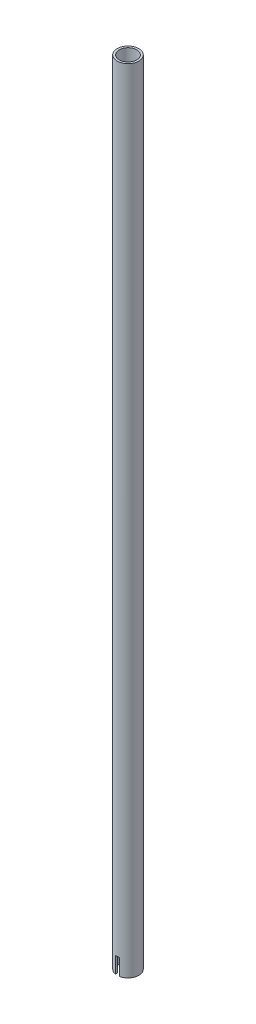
SolidWorks part; units mm, degrees
ref_plane "Front Plane" through (0, 0, 0) normal (0, 0, 1) x (1, 0, 0)
ref_plane "Top Plane" through (0, 0, 0) normal (0, 1, 0) x (1, 0, 0)
ref_plane "Right Plane" through (0, 0, 0) normal (1, 0, 0) x (0, 0, -1)
sketch "Sketch1" plane through (0, 0, 0) normal (0, 1, 0) x (1, 0, 0)
  circle A0 centre (0, 0) radius 13.4874
  circle A1 centre (0, 0) radius 16.6624
extrude "Extrude1" add sketch "Sketch1" against normal blind 1219.2
sketch "Sketch2" plane through (0, 0, 0) normal (0, 0, 1) x (1, 0, 0)
  line L0 (-16.6624, -1219.2) -> (16.6624, -1219.2) construction
  line L1 (-3.175, -1528.0037) -> (3.175, -1528.0037)
  line L2 (-3.175, -1528.0037) -> (-3.175, -1193.8)
  line L3 (-3.175, -1193.8) -> (3.175, -1193.8)
  line L4 (3.175, -1528.0037) -> (3.175, -1193.8)
  line L5 (-16.6624, 0) -> (-16.6624, -1219.2) construction
  dimension "D1" = 6.35
  dimension "D2" = 25.4
  dimension "D3" = 13.4874
extrude "Cut-Extrude1" cut sketch "Sketch2" against normal mid plane 38.1
